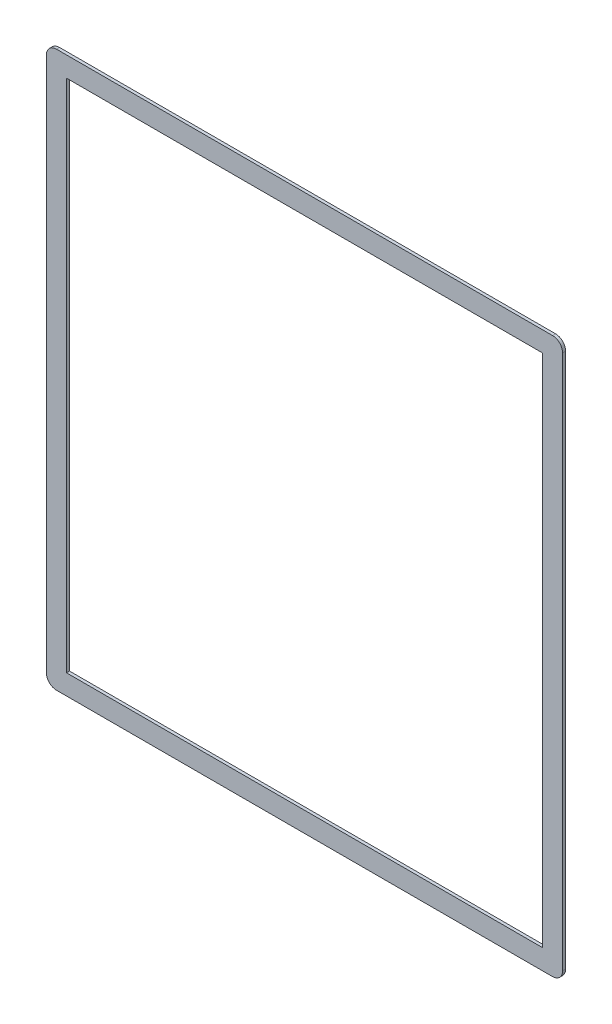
SolidWorks part; units mm, degrees
ref_plane "Front Plane" through (0, 0, 0) normal (0, 0, 1) x (1, 0, 0)
ref_plane "Top Plane" through (0, 0, 0) normal (0, 1, 0) x (1, 0, 0)
ref_plane "Right Plane" through (0, 0, 0) normal (1, 0, 0) x (0, 0, -1)
sketch "Sketch1" plane through (0, 0, 0) normal (0, 0, 1) x (1, 0, 0)
  line L0 (-169.92, 163.5741) -> (-169.92, -174.4999)
  line L1 (-163.57, -180.8499) -> (149.866, -180.8499)
  line L2 (156.216, -174.4999) -> (156.216, 163.5741)
  line L3 (149.866, 169.9241) -> (-163.57, 169.9241)
  arc A0 (-163.57, 169.9241) -> (-169.92, 163.5741) centre (-163.57, 163.5741) ccw
  arc A1 (-169.92, -174.4999) -> (-163.57, -180.8499) centre (-163.57, -174.4999) ccw
  arc A2 (149.866, -180.8499) -> (156.216, -174.4999) centre (149.866, -174.4999) ccw
  arc A3 (156.216, 163.5741) -> (149.866, 169.9241) centre (149.866, 163.5741) ccw
  dimension "D1" = 6.35
  dimension "D2" = 156.216
  dimension "D3" = 350.774
  dimension "D4" = 326.136
  dimension "D5" = 169.9241
extrude "Boss-Extrude1" add sketch "Sketch1" along normal blind 1.905
shell "Shell1" thickness 12.7
